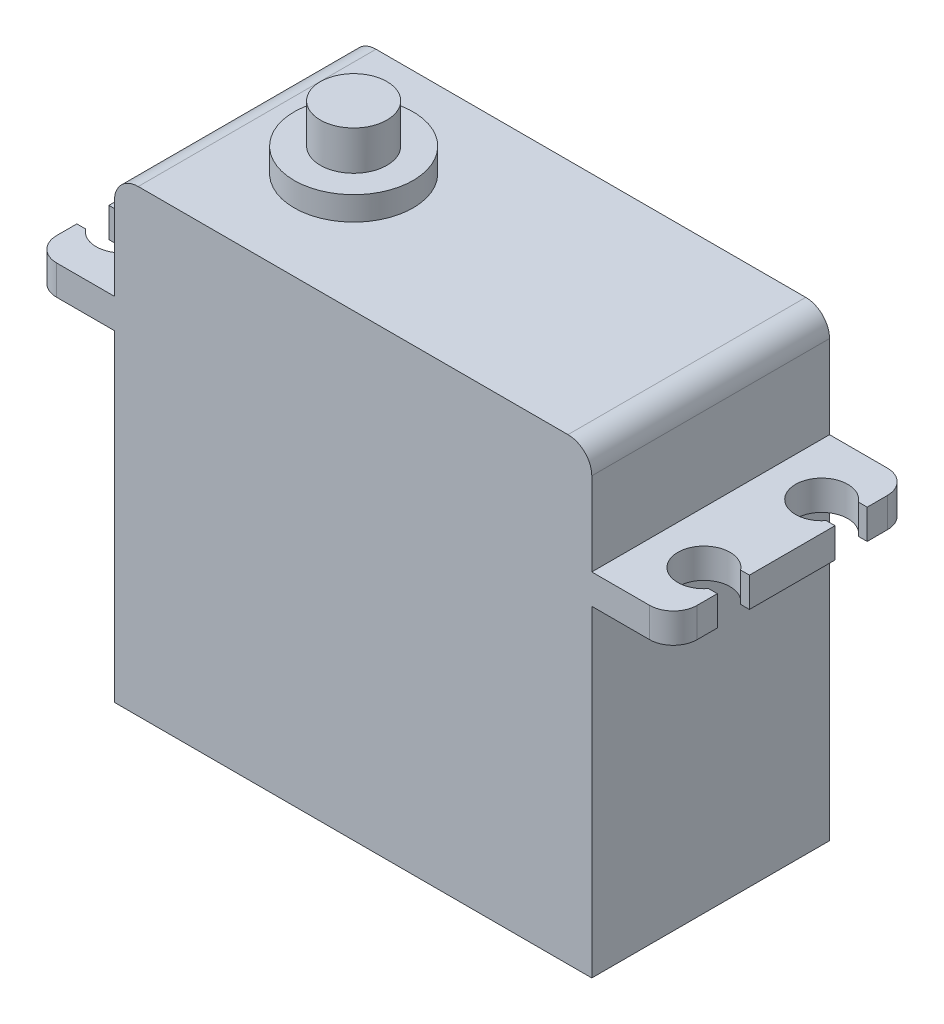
SolidWorks part; units mm, degrees
ref_plane "Front Plane" through (0, 0, 0) normal (0, 0, 1) x (1, 0, 0)
ref_plane "Top Plane" through (0, 0, 0) normal (0, 1, 0) x (1, 0, 0)
ref_plane "Right Plane" through (0, 0, 0) normal (1, 0, 0) x (0, 0, -1)
sketch "Sketch1" plane through (0, 0, 0) normal (0, 1, 0) x (1, 0, 0)
  line L1 (-20.066, -9.9949) -> (20.066, -9.9949)
  line L2 (-20.066, -9.9949) -> (-20.066, 9.9949)
  line L3 (-20.066, 9.9949) -> (20.066, 9.9949)
  line L4 (20.066, -9.9949) -> (20.066, 9.9949)
  line L5 (-20.066, -9.9949) -> (20.066, 9.9949) construction
  line L6 (-20.066, 9.9949) -> (20.066, -9.9949) construction
  point P0 (0, 0)
  dimension "D1" = 40.132
  dimension "D2" = 19.9898
extrude "Boss-Extrude1" add sketch "Sketch1" along normal blind 40.5638
ref_plane "Plane1" through (0, 29.5656, 0) normal (0, 1, 0) x (1, 0, 0)
sketch "Sketch2" plane through (0, 29.5656, 0) normal (0, 1, 0) x (1, 0, 0)
  line L0 (-20.066, -9.9949) -> (20.066, -9.9949) construction
  line L1 (20.066, 9.9949) -> (26.924, 9.9949)
  line L2 (20.066, 9.9949) -> (20.066, -9.9949)
  line L3 (20.066, -9.9949) -> (26.924, -9.9949)
  line L4 (26.924, 9.9949) -> (26.924, -9.9949)
  dimension "D1" = 6.858
extrude "Boss-Extrude2" add sketch "Sketch2" against normal blind 2.5
sketch "Sketch3" plane through (0, 29.5656, 0) normal (0, 1, 0) x (1, 0, 0)
  line L0 (26.1871, 6.3) -> (26.924, 6.3)
  line L1 (26.924, -9.9949) -> (26.924, 9.9949) construction
  line L2 (26.1871, 3.6) -> (26.924, 3.6)
  line L3 (26.924, 6.3) -> (26.924, 3.6)
  arc A0 (26.1871, 6.3) -> (26.1871, 3.6) centre (24.45, 4.95) ccw
  dimension "D1" = 4.4
  dimension "D2" = 24.45
  dimension "D3" = 4.95
  dimension "D4" = 1.35
  dimension "D5" = 1.35
extrude "Cut-Extrude1" cut sketch "Sketch3" against normal up to surface (2.5 mm away)
mirror "Mirror1" about plane through (0, 0, 0) normal (0, 0, 1) of "Cut-Extrude1"
mirror "Mirror2" about plane through (0, 0, 0) normal (1, 0, 0) of "Boss-Extrude2", "Mirror1", "Cut-Extrude1"
sketch "Sketch4" plane through (0, 40.5638, 0) normal (0, 1, 0) x (1, 0, 0)
  circle A0 centre (-9.95, 0) radius 2.8
  arc A1 (-26.1871, 3.6) -> (-26.1871, 6.3) centre (-24.45, 4.95) ccw construction
  dimension "D1" = 5.6
  dimension "D2" = 14.5
extrude "Boss-Extrude3" add sketch "Sketch4" along normal blind 3.3
sketch "Sketch5" plane through (0, 40.5638, 0) normal (0, 1, 0) x (1, 0, 0)
  line L1 (-20.066, 9.9949) -> (20.066, 9.9949)
  line L2 (-20.066, 9.9949) -> (-20.066, -9.9949)
  line L3 (-20.066, -9.9949) -> (20.066, -9.9949)
  line L4 (20.066, 9.9949) -> (20.066, -9.9949)
  circle A0 centre (-9.95, 0) radius 5
  dimension "D1" = 10
extrude "Cut-Extrude2" cut sketch "Sketch5" against normal blind 2 contours A0 M9 M6 M7 M8 | L3 L4 L1 L2
fillet "Fillet1" radius 2 6 edges at (-26.924, 28.3156, -9.9949) (-26.924, 28.3156, 9.9949) (26.924, 28.3156, -9.9949) (26.924, 28.3156, 9.9949) (-20.066, 38.5638, 0) (20.066, 38.5638, 0)
